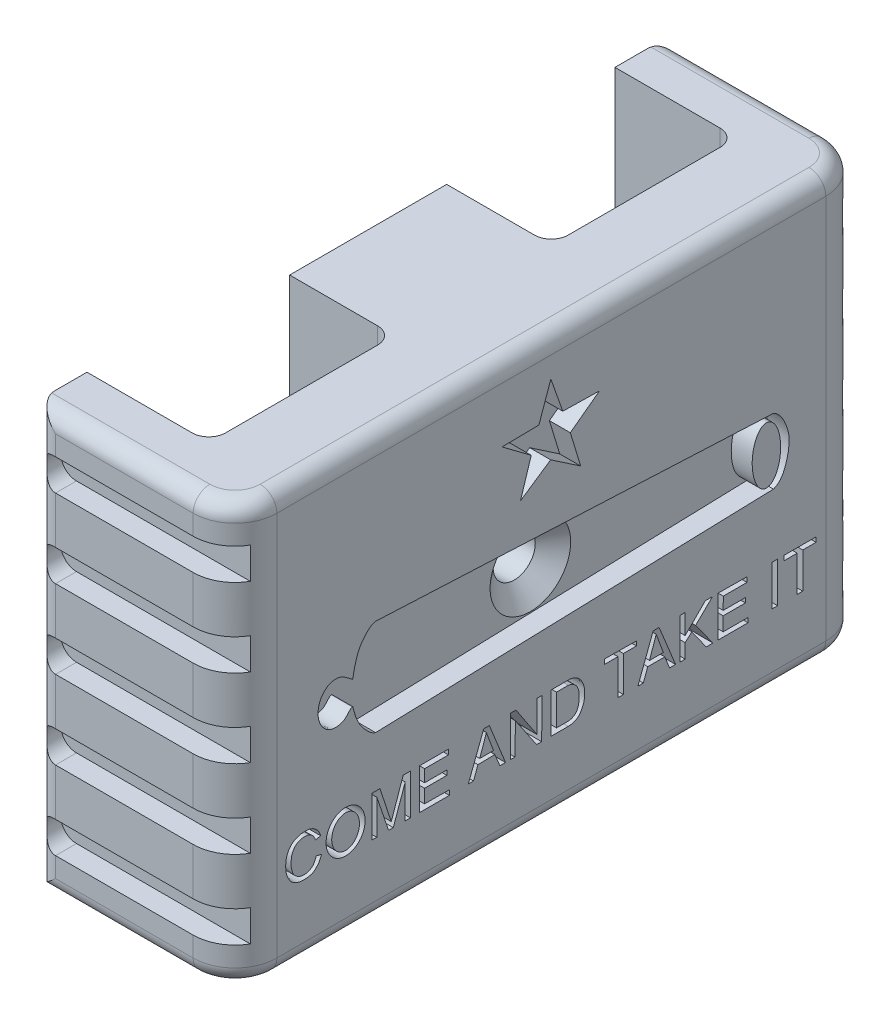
SolidWorks part; units mm, degrees
ref_plane "Front Plane" through (0, 0, 0) normal (0, 0, 1) x (1, 0, 0)
ref_plane "Top Plane" through (0, 0, 0) normal (0, 1, 0) x (1, 0, 0)
ref_plane "Right Plane" through (0, 0, 0) normal (1, 0, 0) x (0, 0, -1)
sketch "Sketch1" plane through (0, 0, 0) normal (0, 1, 0) x (1, 0, 0)
  line L0 (-14.9475, 0) -> (9.3644, 0)
  line L1 (-14.9475, 0) -> (-14.9475, -6.35)
  line L2 (-14.9475, -6.35) -> (-0.1606, -6.35)
  line L3 (-0.1606, -70.4088) -> (-0.1606, -47.9044)
  line L4 (-0.1606, -70.4088) -> (-14.9475, -70.4088)
  line L5 (-14.9475, -70.4088) -> (-14.9475, -76.7588)
  line L6 (-14.9475, -76.7588) -> (9.3644, -76.7588)
  line L7 (9.3644, -76.7588) -> (9.3644, 0)
  line L8 (9.3644, 0) -> (0, 0)
  line L9 (-0.1606, -28.8544) -> (-12.8606, -28.8544)
  line L10 (-12.8606, -28.8544) -> (-12.8606, -47.9044)
  line L11 (-12.8606, -47.9044) -> (-0.1606, -47.9044)
  line L12 (-0.1606, -28.8544) -> (-0.1606, -6.35)
  dimension "D1" = 19.05
  dimension "D2" = 76.7588
  dimension "D3" = 22.5044
  dimension "D4" = 6.35
  dimension "D5" = 9.525
extrude "Boss-Extrude1" add sketch "Sketch1" along normal blind 50.8 contours L12 L9 L10 L11 L3 L4 L5 L6 L7 L0 L1 L2
fillet "Fillet2" radius 5.08 2 edges at (9.3644, 25.4, 76.7588) (9.3644, 25.4, 0)
sketch "Sketch2" plane through (-12.8606, 0, 0) normal (-1, 0, 0) x (0, 0, 1)
  line L0 (33.2994, 4.445) -> (33.2994, 10.795)
  line L1 (33.2994, 10.795) -> (43.4594, 10.795)
  line L2 (43.4594, 10.795) -> (43.4594, 4.445)
  line L3 (33.2994, 15.24) -> (33.2994, 21.59)
  line L4 (33.2994, 21.59) -> (43.4594, 21.59)
  line L5 (43.4594, 21.59) -> (43.4594, 15.24)
  line L6 (33.2994, 4.445) -> (43.4594, 4.445)
  line L7 (33.2994, 15.24) -> (43.4594, 15.24)
  line L8 (28.8544, 50.8) -> (47.9044, 50.8) construction
  line L9 (28.8544, 0) -> (47.9044, 0) construction
  line L10 (47.9044, 50.8) -> (47.9044, 0) construction
  line L11 (28.8544, 50.8) -> (28.8544, 0) construction
  line L12 (33.2994, 29.21) -> (33.2994, 35.56)
  line L13 (33.2994, 35.56) -> (43.4594, 35.56)
  line L14 (43.4594, 35.56) -> (43.4594, 29.21)
  line L15 (33.2994, 29.21) -> (43.4594, 29.21)
  line L16 (33.2994, 40.005) -> (33.2994, 46.355)
  line L17 (33.2994, 46.355) -> (43.4594, 46.355)
  line L18 (43.4594, 46.355) -> (43.4594, 40.005)
  line L19 (33.2994, 40.005) -> (43.4594, 40.005)
  dimension "D1" = 4.445
  dimension "D2" = 4.445
  dimension "D3" = 7.62
  dimension "D4" = 4.445
  dimension "D5" = 4.445
  dimension "D6" = 4.445
  dimension "D7" = 4.445
ref_plane "Plane7" through (-0.1606, 50.8, 6.35) normal (0, -1, 0) x (-1, 0, 0)
fillet "Fillet3" radius 2.54 2 edges at (-14.9475, 25.4, 0) (-14.9475, 25.4, 76.7588)
ref_plane "Plane8" through (-0.1606, 0, 0) normal (-1, 0, 0) x (0, 0, 1)
ref_plane "Plane9" through (9.3644, 0, 0) normal (1, 0, 0) x (0, 0, -1)
fillet "Fillet4" radius 2.032 4 edges at (-0.1606, 25.4, 70.4088) (-0.1606, 25.4, 6.35) (-0.1606, 25.4, 28.8544) (-0.1606, 25.4, 47.9044)
sketch "Sketch4" plane through (9.3644, 0, 0) normal (1, 0, 0) x (0, 0, -1)
  line L0 (-39.5499, 8.7003) -> (-40.1595, 8.7003)
  line L1 (-43.3599, 13.5783) -> (-42.6694, 13.5783)
  line L2 (-59.6999, 31.4272) -> (-11.4299, 29.1419)
  line L3 (-42.7884, 8.7003) -> (-43.3599, 8.7003)
  line L4 (-11.4299, 21.1789) -> (-59.6999, 19.7285)
  line L5 (-40.1199, 13.5402) -> (-39.5118, 13.5402)
  line L6 (-67.0084, 12.086) -> (-66.3665, 12.2268)
  line L7 (-66.9383, 10.3878) -> (-66.2803, 10.2264)
  line L8 (-59.1735, 13.5783) -> (-57.7998, 9.4244)
  line L9 (-57.7998, 9.4244) -> (-56.352, 13.5783)
  line L10 (-55.4736, 13.5783) -> (-55.4736, 8.6573)
  line L11 (-56.1062, 8.6573) -> (-56.1062, 12.7399)
  line L12 (-56.1062, 12.7399) -> (-57.5564, 8.6717)
  line L13 (-58.1199, 8.6717) -> (-59.5491, 12.8576)
  line L14 (-59.5491, 12.8576) -> (-59.559, 8.6573)
  line L15 (-60.162, 8.6717) -> (-60.162, 13.5783)
  line L16 (-54.395, 13.5783) -> (-50.8529, 13.5783)
  line L17 (-50.8529, 12.9664) -> (-53.7537, 12.9664)
  line L18 (-53.7537, 12.9664) -> (-53.7537, 11.4823)
  line L19 (-53.7537, 11.4823) -> (-51.0561, 11.4823)
  line L20 (-51.0561, 10.9107) -> (-53.7612, 10.9107)
  line L21 (-53.7612, 10.9107) -> (-53.7612, 9.2709)
  line L22 (-53.7612, 9.2709) -> (-50.745, 9.2462)
  line L23 (-50.745, 8.6573) -> (-54.395, 8.6573)
  line L24 (-54.395, 8.6573) -> (-54.395, 13.5783)
  line L25 (-45.8982, 13.5702) -> (-43.9314, 8.7003)
  line L26 (-44.6188, 8.7003) -> (-45.2268, 10.1866)
  line L27 (-45.2268, 10.1866) -> (-47.2842, 10.1485)
  line L28 (-47.2842, 10.1485) -> (-47.8176, 8.7003)
  line L29 (-48.4513, 8.7003) -> (-46.5785, 13.5702)
  line L30 (-42.6694, 13.5783) -> (-40.1199, 9.7445)
  line L31 (-40.1199, 9.7445) -> (-40.1199, 13.5402)
  line L32 (-39.5118, 13.5402) -> (-39.5499, 8.7003)
  line L33 (-40.1595, 8.7003) -> (-42.737, 12.4948)
  line L34 (-42.737, 12.4948) -> (-42.7884, 8.7003)
  line L35 (-43.3599, 8.7003) -> (-43.3599, 13.5783)
  line L36 (-31.9052, 13.5781) -> (-28.0437, 13.5402)
  line L37 (-28.0437, 13.0067) -> (-29.6349, 13.0067)
  line L38 (-29.6349, 13.0067) -> (-29.6349, 8.6989)
  line L39 (-30.2916, 8.6989) -> (-30.2916, 13.0067)
  line L40 (-30.2916, 13.0067) -> (-31.9052, 13.0067)
  line L41 (-25.3016, 13.5783) -> (-23.3011, 8.6893)
  line L42 (-24.033, 8.6893) -> (-24.6084, 10.1432)
  line L43 (-24.6084, 10.1432) -> (-26.676, 10.1432)
  line L44 (-26.676, 10.1432) -> (-27.2115, 8.6989)
  line L45 (-27.8726, 8.6989) -> (-26.0244, 13.5783)
  line L46 (-22.1382, 13.5783) -> (-22.1382, 11.1417)
  line L47 (-18.8276, 13.5783) -> (-20.8783, 11.578)
  line L48 (-20.8783, 11.578) -> (-18.7669, 8.6748)
  line L49 (-19.5859, 8.6748) -> (-21.3398, 11.1417)
  line L50 (-22.7859, 8.6704) -> (-22.7859, 13.5783)
  line L51 (-18.1758, 13.604) -> (-14.6325, 13.5783)
  line L52 (-14.6325, 12.9782) -> (-17.5135, 12.9782)
  line L53 (-17.5135, 12.9782) -> (-17.5281, 11.4823)
  line L54 (-17.5281, 11.4823) -> (-14.823, 11.4823)
  line L55 (-14.823, 10.9169) -> (-17.5283, 10.9169)
  line L56 (-17.5283, 10.9169) -> (-17.5283, 9.2338)
  line L57 (-17.5283, 9.2338) -> (-14.5182, 9.2338)
  line L58 (-14.5182, 8.6777) -> (-18.1758, 8.6748)
  line L59 (-18.1758, 8.6748) -> (-18.1758, 13.604)
  line L60 (-10.9271, 13.5783) -> (-10.9271, 8.6777)
  line L61 (-11.5845, 8.6777) -> (-11.5845, 13.5783)
  line L62 (-10.155, 13.5783) -> (-6.2677, 13.5783)
  line L63 (-6.2677, 13.0067) -> (-7.8728, 13.0067)
  line L64 (-7.8728, 13.0067) -> (-7.8728, 8.6777)
  line L65 (-8.5423, 8.6777) -> (-8.5423, 13.0067)
  line L66 (-8.5423, 13.0067) -> (-10.155, 13.0067)
  line L67 (-38.4388, 46.2511) -> (-36.9866, 42.1376)
  line L68 (-36.9866, 42.1376) -> (-32.5326, 42.0562)
  line L69 (-32.5326, 42.0562) -> (-36.0729, 39.4265)
  line L70 (-36.0729, 39.4265) -> (-34.8206, 35.3009)
  line L71 (-34.8206, 35.3009) -> (-38.459, 37.7719)
  line L72 (-38.459, 37.7719) -> (-42.1148, 35.3009)
  line L73 (-42.1148, 35.3009) -> (-40.8196, 39.4265)
  line L74 (-40.8196, 39.4265) -> (-44.3624, 42.0755)
  line L75 (-44.3624, 42.0755) -> (-39.8879, 42.1376)
  line L76 (-39.8879, 42.1376) -> (-38.4388, 46.2511)
  line L77 (-46.5785, 13.5702) -> (-45.8982, 13.5702)
  line L78 (-47.0625, 10.6913) -> (-46.2575, 13.0067)
  line L79 (-46.2575, 13.0067) -> (-45.3993, 10.6913)
  line L80 (-45.3993, 10.6913) -> (-47.0625, 10.6913)
  line L81 (-48.4513, 8.7003) -> (-47.8176, 8.7003)
  line L82 (-44.6188, 8.7003) -> (-43.9314, 8.7003)
  line L83 (-50.745, 8.6573) -> (-50.745, 9.2462)
  line L84 (-51.0561, 10.9107) -> (-51.0561, 11.4823)
  line L85 (-50.8529, 12.9664) -> (-50.8529, 13.5783)
  line L86 (-56.1062, 8.6573) -> (-55.4736, 8.6573)
  line L87 (-56.352, 13.5783) -> (-55.4736, 13.5783)
  line L88 (-58.1199, 8.6717) -> (-57.5564, 8.6717)
  line L89 (-59.559, 8.6573) -> (-60.162, 8.6717)
  line L90 (-60.162, 13.5783) -> (-59.1735, 13.5783)
  line L91 (-31.9052, 13.5781) -> (-31.9052, 13.0067)
  line L92 (-28.0437, 13.5402) -> (-28.0437, 13.0067)
  line L93 (-30.2916, 8.6989) -> (-29.6349, 8.6989)
  line L94 (-27.8726, 8.6989) -> (-27.2115, 8.6989)
  line L95 (-24.033, 8.6893) -> (-23.3011, 8.6893)
  line L96 (-22.1382, 11.1417) -> (-19.7023, 13.5783)
  line L97 (-26.0244, 13.5783) -> (-25.3016, 13.5783)
  line L98 (-25.6589, 13.0448) -> (-26.4629, 10.6913)
  line L99 (-26.4629, 10.6913) -> (-24.7864, 10.6913)
  line L100 (-24.7864, 10.6913) -> (-25.6589, 13.0448)
  line L101 (-22.7859, 13.5783) -> (-22.1382, 13.5783)
  line L102 (-22.7859, 8.6704) -> (-22.1382, 8.6704)
  line L103 (-19.5859, 8.6748) -> (-18.7669, 8.6748)
  line L104 (-14.823, 10.9169) -> (-14.823, 11.4823)
  line L105 (-14.6325, 12.9782) -> (-14.6325, 13.5783)
  line L106 (-14.5182, 8.6777) -> (-14.5182, 9.2338)
  line L107 (-11.5845, 13.5783) -> (-10.9271, 13.5783)
  line L108 (-11.5845, 8.6777) -> (-10.9271, 8.6777)
  line L109 (-38.4044, 13.5628) -> (-38.4483, 8.6962)
  line L110 (-8.5423, 8.6777) -> (-7.8728, 8.6777)
  line L111 (-10.155, 13.0067) -> (-10.155, 13.5783)
  line L112 (-6.2677, 13.0067) -> (-6.2677, 13.5783)
  line L113 (-19.7023, 13.5783) -> (-18.8276, 13.5783)
  line L114 (-21.3398, 11.1417) -> (-22.1382, 10.4019)
  line L115 (-22.1382, 10.4019) -> (-22.1382, 8.6704)
  line L116 (-38.4483, 8.6962) -> (-36.3245, 8.6962)
  line L117 (-38.4044, 13.5628) -> (-36.1325, 13.5628)
  line L118 (-36.3245, 9.2462) -> (-37.7485, 9.2462)
  line L119 (-37.7485, 9.2462) -> (-37.7485, 13.0067)
  line L120 (-37.7485, 13.0067) -> (-36.3245, 13.0067)
  line L121 (-28.8544, 50.8) -> (-28.8544, 0) construction
  line L122 (-28.8544, 50.8) -> (-47.9044, 50.8) construction
  ellipse E0 centre (-63.3398, 11.1407) end of major axis (-63.3146, 8.5895) minor radius 2.3698
  ellipse E1 centre (-12.2848, 25.147) end of major axis (-12.2848, 28.578) minor radius 1.7265
  ellipse E2 centre (-63.3398, 11.1407) end of major axis (-63.3398, 13.121) minor radius 1.6842
  spline S0 degree 3 poles (-63.4399, 27.4184) (-63.9719, 27.8523) (-65.246, 27.8901) (-66.4377, 26.702) (-66.8243, 25.2232) (-66.426, 23.6899) (-65.4006, 22.7314) (-64.3219, 22.6522) (-63.3617, 22.931) (-62.9611, 23.5667) (-62.6042, 23.8483) (-62.5241, 23.832) knots 0 0 0 0 0.186788 0.296685 0.444061 0.588488 0.717634 0.799818 0.878909 0.979986 1 1 1 1
  spline S1 degree 3 poles (-63.4399, 27.4184) (-63.2091, 27.2493) (-62.6196, 26.8465) (-62.561, 26.7551) knots 0 0 0 0 1 1 1 1
  spline S2 degree 3 poles (-59.6999, 31.4272) (-60.2103, 31.3457) (-60.7452, 30.8125) (-61.4596, 30.0021) (-61.8893, 29.1462) (-62.1458, 28.2976) (-62.3113, 27.5829) (-62.412, 27.0349) (-62.4429, 26.8197) (-62.5077, 26.7268) (-62.561, 26.7551) knots 0 0 0 0 0.2546 0.380765 0.562119 0.748481 0.832757 0.962236 0.97896 1 1 1 1
  spline S3 degree 3 poles (-59.6999, 19.7285) (-60.1877, 19.8954) (-60.7417, 20.415) (-61.4316, 21.2242) (-61.8631, 21.9588) (-62.1504, 22.647) (-62.306, 23.2335) (-62.4245, 23.628) (-62.4462, 23.8501) (-62.5241, 23.832) knots 0 0 0 0 0.290562 0.431015 0.614236 0.780846 0.857482 0.970399 1 1 1 1
  spline S4 degree 3 poles (-11.4299, 29.1419) (-10.6452, 28.7553) (-9.983, 27.5299) (-9.5295, 26.052) (-9.5227, 25.0536) (-9.6172, 24.1112) (-10.0112, 22.6331) (-10.611, 21.459) (-11.4299, 21.1789) knots 0 0 0 0 0.273352 0.432751 0.499757 0.596869 0.739925 1 1 1 1
  spline S5 degree 3 poles (-36.3245, 13.0067) (-35.9545, 12.9754) (-35.4086, 12.6812) (-35.0694, 11.9938) (-34.9748, 11.391) (-35.028, 10.7776) (-35.0862, 10.1186) (-35.4903, 9.4563) (-36.0236, 9.2643) (-36.3245, 9.2462) knots 0 0 0 0 0.216502 0.331903 0.43747 0.570131 0.691807 0.82186 1 1 1 1
  spline S6 degree 3 poles (-67.0084, 12.086) (-67.0727, 12.4165) (-67.4349, 12.9748) (-68.1172, 13.1073) (-68.6139, 13.1138) (-69.0261, 12.9934) (-69.4846, 12.6994) (-69.6995, 12.3293) (-69.9011, 11.8789) (-69.9516, 11.3351) (-69.9895, 10.7915) (-69.8245, 10.2345) (-69.6874, 9.7371) (-69.2557, 9.4055) (-68.8222, 9.1491) (-68.4939, 9.133) (-68.1912, 9.1302) (-67.815, 9.2156) (-67.3717, 9.4547) (-67.2269, 9.6641) (-67.1033, 9.8739) (-67.0282, 10.0124) (-66.9629, 10.1682) (-66.9646, 10.1438) (-66.9383, 10.3878) knots 0 0 0 0 0.117047 0.171813 0.218545 0.265665 0.312289 0.367205 0.414976 0.459944 0.537239 0.580927 0.641017 0.690752 0.747005 0.787856 0.797323 0.84168 0.888081 0.932033 0.939191 0.957385 0.963694 1 1 1 1
  spline S7 degree 3 poles (-36.1325, 13.5628) (-35.7067, 13.5115) (-35.04, 13.2249) (-34.563, 12.4214) (-34.3462, 11.8048) (-34.367, 11.1821) (-34.3328, 10.6547) (-34.5028, 10.0523) (-34.7819, 9.4704) (-35.3437, 8.8029) (-35.9829, 8.7149) (-36.3245, 8.6962) knots 0 0 0 0 0.191149 0.289804 0.402843 0.471551 0.56131 0.632462 0.742344 0.844349 1 1 1 1
  spline S8 degree 3 poles (-66.3665, 12.2268) (-66.4614, 12.571) (-66.7341, 13.0808) (-67.317, 13.4577) (-67.7986, 13.6427) (-68.3299, 13.6427) (-68.8951, 13.6152) (-69.406, 13.4061) (-69.8694, 13.1392) (-70.2097, 12.7169) (-70.483, 12.1974) (-70.5895, 11.6615) (-70.6184, 11.0864) (-70.5878, 10.5562) (-70.4538, 10.0187) (-70.2323, 9.5717) (-69.9855, 9.1769) (-69.6268, 8.9249) (-69.3003, 8.7642) (-68.8763, 8.6294) (-68.366, 8.5976) (-67.8488, 8.6428) (-67.4387, 8.7519) (-67.1103, 8.9139) (-66.8525, 9.1958) (-66.5742, 9.4687) (-66.4349, 9.8479) (-66.2845, 10.0733) (-66.2803, 10.2264) knots 0 0 0 0 0.082356 0.124489 0.15618 0.198662 0.244335 0.28426 0.323359 0.365024 0.405904 0.456462 0.487995 0.537351 0.577094 0.613307 0.651172 0.681527 0.711813 0.734115 0.782596 0.827231 0.85206 0.879251 0.909226 0.938728 0.96688 1 1 1 1
  point P241 (-38.3794, 25.4)
  dimension "D1" = 9.525
  dimension "D2" = 25.4
fillet "Fillet5" radius 2.032 10 edges at (7.8765, 50.8, 75.2709) (9.3644, 50.8, 38.3794) (7.8765, 50.8, 1.4879) (-4.0615, 50.8, 0) (-4.0615, 0, 0) (7.8765, 0, 1.4879) (9.3644, 0, 38.3794) (7.8765, 0, 75.2709) (-4.0615, 0, 76.7588) (-4.0615, 50.8, 76.7588)
extrude "Cut-Extrude4" cut sketch "Sketch2" against normal blind 9.525
extrude "Cut-Extrude5" cut sketch "Sketch4" against normal blind 2.54
hole_wizard "CSK for #10 Flat Head Machine Screw (100)1" positions "Sketch6" profile "Sketch5" countersink size "#10" standard "ANSI Inch"
sketch "Sketch6" plane through (6.8244, 0, 0) normal (1, 0, 0) x (0, 0, -1)
  line L0 (-47.9044, 50.8) -> (-47.9044, 0) construction
  line L1 (-28.8544, 50.8) -> (-47.9044, 50.8) construction
  point P0 (-38.3794, 25.4)
  dimension "D1" = 9.525
  dimension "D2" = 25.4
sketch "Sketch5" plane through (6.8244, 25.4, 38.3794) normal (0, 1, 0) x (0, 0, -1)
  line L0 (0, 0) -> (0, 21.7719)
  line L1 (0, 21.7719) -> (2.5527, 21.7719)
  line L2 (2.5527, 21.7719) -> (2.5527, 1.9608)
  line L3 (2.5527, 1.9608) -> (4.8895, 0)
  line L5 (4.8895, 0) -> (0, 0)
  line L6 (-2.5527, 1.9608) -> (-4.8895, 0) construction
  line L11 (0, -6.35) -> (0, 107.95) construction
  dimension "Thru Hole Dia." = 5.1054
  dimension "Thru Hole Depth" = 21.7719
  dimension "Near C'Sink Dia." = 9.779
  dimension "Near C'Sink Angle" = 100
sketch "Sketch10" plane through (0, 0, 76.7588) normal (0, 0, 1) x (1, 0, 0)
  line L0 (-12.4075, 44.45) -> (9.3644, 44.45) construction
  line L1 (-12.4075, 48.768) -> (-12.4075, 2.032) construction
  line L2 (9.3644, -25.7048) -> (9.3644, 25.7048) construction
  line L3 (-12.4075, 46.355) -> (9.3644, 46.355)
  line L4 (-12.4075, 42.545) -> (9.3644, 42.545)
  line L5 (-12.4075, 34.925) -> (9.3644, 34.925) construction
  line L6 (-12.4075, 36.83) -> (9.3644, 36.83)
  line L7 (-12.4075, 33.02) -> (9.3644, 33.02)
  line L8 (-12.4075, 25.4) -> (9.3644, 25.4) construction
  line L9 (-12.4075, 27.305) -> (9.3644, 27.305)
  line L10 (-12.4075, 23.495) -> (9.3644, 23.495)
  line L11 (-12.4075, 15.875) -> (9.3644, 15.875) construction
  line L12 (-12.4075, 17.78) -> (9.3644, 17.78)
  line L13 (-12.4075, 13.97) -> (9.3644, 13.97)
  line L14 (-12.4075, 6.35) -> (9.3644, 6.35) construction
  line L15 (-12.4075, 8.255) -> (9.3644, 8.255)
  line L16 (-12.4075, 4.445) -> (9.3644, 4.445)
  line L18 (-14.8961, 50.8) -> (4.2844, 50.8) construction
  arc A0 (-12.4075, 46.355) -> (-12.4075, 42.545) centre (-12.4075, 44.45) ccw
  arc A1 (9.3644, 42.545) -> (9.3644, 46.355) centre (9.3644, 44.45) ccw
  arc A2 (-12.4075, 36.83) -> (-12.4075, 33.02) centre (-12.4075, 34.925) ccw
  arc A3 (9.3644, 33.02) -> (9.3644, 36.83) centre (9.3644, 34.925) ccw
  arc A4 (-12.4075, 27.305) -> (-12.4075, 23.495) centre (-12.4075, 25.4) ccw
  arc A5 (9.3644, 23.495) -> (9.3644, 27.305) centre (9.3644, 25.4) ccw
  arc A6 (-12.4075, 17.78) -> (-12.4075, 13.97) centre (-12.4075, 15.875) ccw
  arc A7 (9.3644, 13.97) -> (9.3644, 17.78) centre (9.3644, 15.875) ccw
  arc A8 (-12.4075, 8.255) -> (-12.4075, 4.445) centre (-12.4075, 6.35) ccw
  arc A9 (9.3644, 4.445) -> (9.3644, 8.255) centre (9.3644, 6.35) ccw
  point P6 (-1.5215, 44.45)
  point P11 (-1.5215, 34.925)
  point P18 (-1.5215, 25.4)
  point P25 (-1.5215, 15.875)
  point P32 (-1.5215, 6.35)
  dimension "D1" = 6.35
  dimension "D2" = 9.525
  dimension "D3" = 9.525
  dimension "D4" = 9.525
  dimension "D5" = 9.525
  dimension "D6" = 3.81
  dimension "D7" = 3.81
  dimension "D8" = 3.81
  dimension "D9" = 3.81
  dimension "D10" = 3.81
extrude "Cut-Extrude8" cut sketch "Sketch10" against normal blind 2.54
ref_plane "Plane11" through (0, 0, 38.1) normal (0, 0, -1) x (-1, 0, 0)
mirror "Mirror3" about plane through (0, 0, 38.1) normal (0, 0, -1) of "Cut-Extrude8"
ref_plane "Plane10" through (0, 0, 38.1) normal (0, 0, -1) x (-1, 0, 0)
